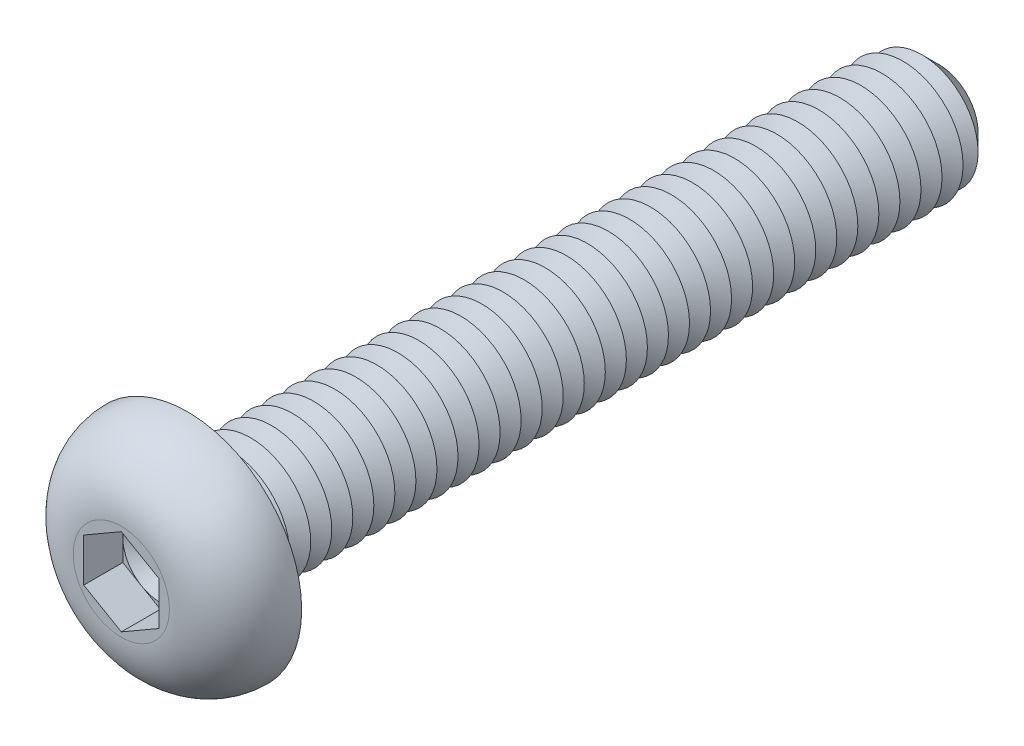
SolidWorks part; units mm, degrees
ref_plane "Front Plane" through (0, 0, 0) normal (0, 0, 1) x (1, 0, 0)
ref_plane "Top Plane" through (0, 0, 0) normal (0, 1, 0) x (1, 0, 0)
ref_plane "Right Plane" through (0, 0, 0) normal (1, 0, 0) x (0, 0, -1)
sketch "Sketch1" plane through (0, 0, 0) normal (1, 0, 0) x (0, 0, -1)
  line L0 (-47.9342, 0) -> (60.3146, 0) construction
sketch "Sketch2" plane through (0, 0, 0) normal (1, 0, 0) x (0, 0, -1)
  line L0 (0, 0) -> (-2.2, 0)
  line L1 (-47.9342, 0) -> (60.3146, 0) construction
  line L2 (-2.2, 0) -> (-2.2, 1.6)
  line L3 (0, 3.8) -> (0, 0)
  arc A0 (-2.2, 1.6) -> (0, 3.8) centre (0, 1.6) cw
  dimension "D1" = 2.2
  dimension "D2" = 2.2
  dimension "D3" = 3.8
revolve "Revolve1" add sketch "Sketch2" angle 360 about L0
sketch "Sketch3" plane through (0, 0, 2.2) normal (0, 0, 1) x (1, 0, 0)
  line L1 (0, 1.4434) -> (-1.25, 0.7217)
  line L2 (-1.25, 0.7217) -> (-1.25, -0.7217)
  line L3 (-1.25, -0.7217) -> (0, -1.4434)
  line L4 (0, -1.4434) -> (1.25, -0.7217)
  line L5 (1.25, -0.7217) -> (1.25, 0.7217)
  line L6 (1.25, 0.7217) -> (0, 1.4434)
  circle A0 centre (0, 0) radius 1.25 construction
  dimension "D1" = 2.5
extrude "Cut-Extrude1" cut sketch "Sketch3" against normal blind 1.3
sketch "Sketch4" plane through (0, 0, 0) normal (0, 0, -1) x (-1, 0, 0)
  circle A0 centre (0, 0) radius 2
  dimension "D1" = 4
extrude "Boss-Extrude1" add sketch "Sketch4" along normal blind 25
chamfer "Chamfer1" distance 0.7 angle 45 1 edges at (-2, 0, -25)
sketch "Sketch5" plane through (0, 0, 0) normal (1, 0, 0) x (0, 0, -1)
  line L0 (0.7, 2) -> (1.4, 2)
  line L1 (24.3, 2) -> (0, 2) construction
  line L2 (1.4, 2) -> (1.05, 1.3938)
  line L3 (1.05, 1.3938) -> (0.7, 2)
  line L4 (0, -3.8) -> (0, 3.8) construction
  line L5 (24.3, 2) -> (0, 2) construction
  dimension "D1" = 0.7
  dimension "D2" = 0.7
revolve "Cut-Revolve1" cut sketch "Sketch5" angle 360 about L0
pattern_linear "LPattern1" count 34 spacing 0.7 along (0, 0, -1) of "Cut-Revolve1"
fillet "Fillet2" radius 0.3 1 edges at (2, 0, 0)
sketch "Sketch6" plane through (0, 0, 0.9) normal (0, 0, 1) x (1, 0, 0)
  line L0 (0, -1.4434) -> (1.25, -0.7217) construction
  circle A0 centre (0, 0) radius 1.25
extrude "Cut-Extrude2" cut sketch "Sketch6" against normal through all draft 60
